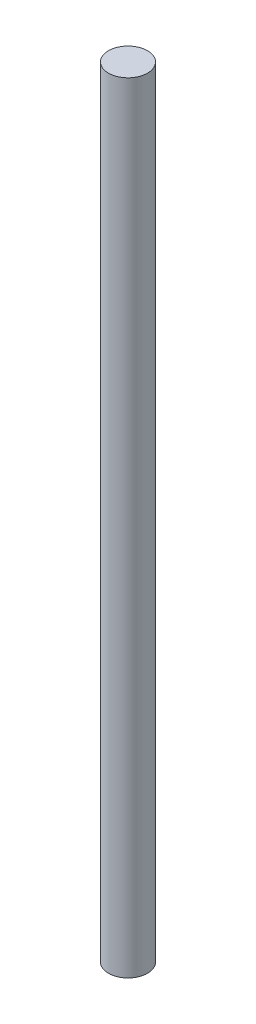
SolidWorks part; units mm, degrees
ref_plane "Front Plane" through (0, 0, 0) normal (0, 0, 1) x (1, 0, 0)
ref_plane "Top Plane" through (0, 0, 0) normal (0, 1, 0) x (1, 0, 0)
ref_plane "Right Plane" through (0, 0, 0) normal (1, 0, 0) x (0, 0, -1)
sketch "Sketch1" plane through (0, 0, 0) normal (0, 1, 0) x (1, 0, 0)
  circle A0 centre (0, 0) radius 12.7
  dimension "D1" = 25.4
extrude "Boss-Extrude1" add sketch "Sketch1" against normal blind 508
